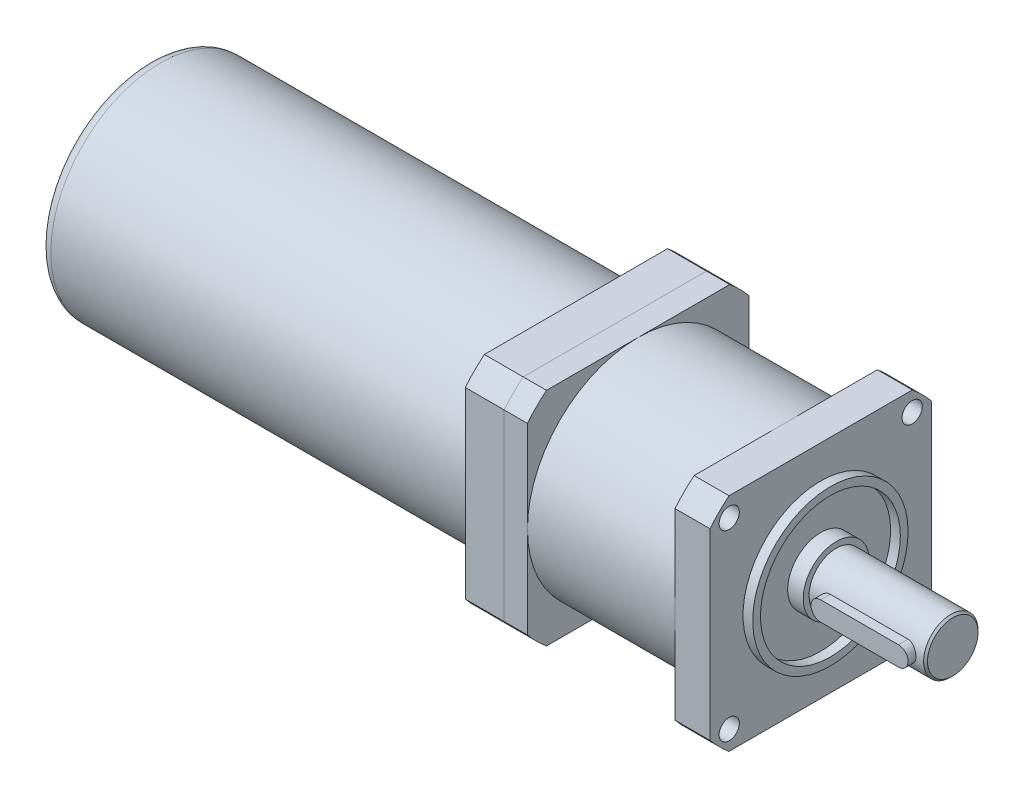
SolidWorks part; units mm, degrees
ref_plane "前视基准面" through (0, 0, 0) normal (0, 0, 1) x (1, 0, 0)
ref_plane "上视基准面" through (0, 0, 0) normal (0, 1, 0) x (1, 0, 0)
ref_plane "右视基准面" through (0, 0, 0) normal (1, 0, 0) x (0, 0, -1)
sketch "草图1" plane through (0, 0, 0) normal (1, 0, 0) x (0, 0, -1)
  line L1 (-23.5956, -28.5) -> (23.5956, -28.5)
  line L2 (-28.5, -23.5956) -> (-28.5, 23.5956)
  line L3 (-23.5956, 28.5) -> (23.5956, 28.5)
  line L4 (28.5, -23.5956) -> (28.5, 23.5956)
  line L5 (-26.163, -26.163) -> (26.163, 26.163) construction
  line L6 (-26.163, 26.163) -> (26.163, -26.163) construction
  arc A0 (-28.5, -23.5956) -> (-23.5956, -28.5) centre (0, 0) ccw
  arc A1 (-23.5956, 28.5) -> (-28.5, 23.5956) centre (0, 0) ccw
  arc A2 (28.5, 23.5956) -> (23.5956, 28.5) centre (0, 0) ccw
  arc A3 (23.5956, -28.5) -> (28.5, -23.5956) centre (0, 0) ccw
  point P0 (0, 0)
extrude "凸台-拉伸1" add sketch "草图1" against normal blind 9
sketch "草图2" plane through (-9, 0, 0) normal (-1, 0, 0) x (0, 0, 1)
  circle A0 centre (0, 0) radius 28.5
extrude "凸台-拉伸2" add sketch "草图2" along normal blind 38
sketch "草图3" plane through (-47, 0, 0) normal (-1, 0, 0) x (0, 0, 1)
  line L1 (-23.5956, -28.5) -> (23.5956, -28.5)
  line L2 (-28.5, -23.5956) -> (-28.5, 23.5956)
  line L3 (-23.5956, 28.5) -> (23.5956, 28.5)
  line L4 (28.5, -23.5956) -> (28.5, 23.5956)
  line L5 (-26.163, -26.163) -> (26.163, 26.163) construction
  line L6 (-26.163, 26.163) -> (26.163, -26.163) construction
  arc A0 (-28.5, -23.5956) -> (-23.5956, -28.5) centre (0, 0) ccw
  arc A1 (23.5956, -28.5) -> (28.5, -23.5956) centre (0, 0) ccw
  arc A2 (28.5, 23.5956) -> (23.5956, 28.5) centre (0, 0) ccw
  arc A3 (-23.5956, 28.5) -> (-28.5, 23.5956) centre (0, 0) ccw
  point P0 (0, 0)
extrude "凸台-拉伸3" add sketch "草图3" along normal blind 6
sketch "草图6" plane through (0, 0, 0) normal (1, 0, 0) x (0, 0, -1)
  circle A0 centre (-23.55, 23.55) radius 2.6
  circle A1 centre (23.55, 23.55) radius 2.6
  circle A2 centre (23.55, -23.55) radius 2.6
  circle A3 centre (-23.55, -23.55) radius 2.6
  point P0 (0, 0)
extrude "切除-拉伸2" cut sketch "草图6" against normal blind 9
sketch "草图7" plane through (0, 0, 0) normal (1, 0, 0) x (0, 0, -1)
  circle A0 centre (0, 0) radius 20
  circle A1 centre (0, 0) radius 18
extrude "凸台-拉伸5" add sketch "草图7" along normal blind 2.5
sketch "草图8" plane through (0, 0, 0) normal (1, 0, 0) x (0, 0, -1)
  circle A0 centre (0, 0) radius 8.5
extrude "凸台-拉伸6" add sketch "草图8" along normal blind 4
sketch "草图9" plane through (4, 0, 0) normal (1, 0, 0) x (0, 0, -1)
  circle A0 centre (0, 0) radius 7
extrude "凸台-拉伸7" add sketch "草图9" along normal blind 30
ref_plane "基准面1" through (0, 0, 7) normal (0, 0, 1) x (1, 0, 0)
sketch "草图10" plane through (0, 0, 7) normal (0, 0, 1) x (1, 0, 0)
  line L3 (9, 2.5) -> (29, 2.5)
  line L5 (29, -2.5) -> (9, -2.5)
  arc A0 (29, -2.5) -> (29, 2.5) centre (29, 0) ccw
  arc A1 (9, 2.5) -> (9, -2.5) centre (9, 0) ccw
extrude "切除-拉伸3" cut sketch "草图10" against normal blind 3
sketch "草图11" plane through (0, 0, 4) normal (0, 0, 1) x (1, 0, 0)
  line L0 (9, 2.5) -> (29, 2.5)
  line L2 (29, -2.5) -> (9, -2.5)
  arc A0 (9, 2.5) -> (9, -2.5) centre (9, 0) ccw
  arc A1 (29, -2.5) -> (29, 2.5) centre (29, 0) ccw
extrude "凸台-拉伸8" add sketch "草图11" along normal blind 5
chamfer "倒角1" distance 0.5 angle 45 1 edges at (34, 0, -7)
sketch "草图14" plane through (-53, 0, 0) normal (-1, 0, 0) x (0, 0, 1)
  line L1 (-23.5956, -28.5) -> (23.5956, -28.5)
  line L2 (-28.5, -23.5956) -> (-28.5, 23.5956)
  line L3 (-23.5956, 28.5) -> (23.5956, 28.5)
  line L4 (28.5, -23.5956) -> (28.5, 23.5956)
  line L5 (-26.163, -26.163) -> (26.163, 26.163) construction
  line L6 (-26.163, 26.163) -> (26.163, -26.163) construction
  arc A0 (-23.5956, 28.5) -> (-28.5, 23.5956) centre (0, 0) ccw
  arc A1 (-28.5, -23.5956) -> (-23.5956, -28.5) centre (0, 0) ccw
  arc A2 (23.5956, -28.5) -> (28.5, -23.5956) centre (0, 0) ccw
  arc A3 (28.5, 23.5956) -> (23.5956, 28.5) centre (0, 0) ccw
  point P0 (0, 0)
extrude "凸台-拉伸9" add sketch "草图14" along normal blind 10 separate body
sketch "草图15" plane through (-63, 0, 0) normal (-1, 0, 0) x (0, 0, 1)
  circle A0 centre (0, 0) radius 28.2
extrude "凸台-拉伸10" add sketch "草图15" along normal blind 110
fillet "圆角1" radius 3 1 edges at (-173, 0, 28.2)
